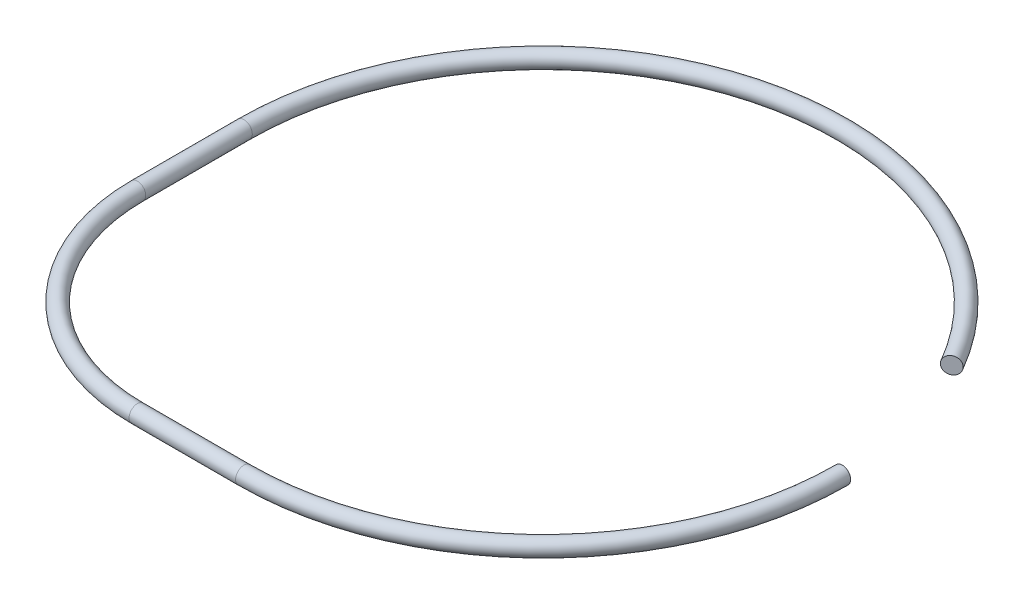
SolidWorks part; units mm, degrees
ref_plane "Front" through (0, 0, 0) normal (0, 0, 1) x (1, 0, 0)
ref_plane "Top" through (0, 0, 0) normal (0, 1, 0) x (1, 0, 0)
ref_plane "Right" through (0, 0, 0) normal (1, 0, 0) x (0, 0, -1)
sketch "Sketch1" plane through (0, 0, 0) normal (0, 0, 1) x (1, 0, 0)
  circle A0 centre (56.75, 0) radius 1.5875
  dimension "D2" = 3.175
  dimension "D1" = 56.75
sketch "Sketch2" plane through (0, 0, 0) normal (0, 1, 0) x (1, 0, 0)
  line L0 (0, 0) -> (56.7154, 1.9805) construction
  line L1 (0, 0) -> (49.1469, 28.375) construction
  line L2 (0, 0) -> (0, 26.5036) construction
  line L3 (0, 0) -> (0, -32.5263) construction
  line L4 (0, 0) -> (-20.2056, -20.2056) construction
  line L5 (0, -56.75) -> (-20.2056, -56.7499)
  line L6 (-56.75, 0) -> (-56.75, -20.2056)
  arc A0 (49.1469, 28.375) -> (-56.75, 0) centre (0, 0) ccw
  arc A1 (-56.75, -20.2056) -> (-20.2056, -56.7499) centre (-20.2056, -20.2056) ccw
  arc A2 (0, -56.75) -> (56.7154, 1.9805) centre (0, 0) ccw
  dimension "D4" = 45
  dimension "D1" = 88
  dimension "D2" = 60
  dimension "D3" = 28.575
  dimension "D6" = 90
sweep "Sweep1" add profiles "Sketch1" path "Sketch2"
equation "\"Buoyancy\"=\"SW-Volume\"*(\"SW-Density\"-.037062)"
